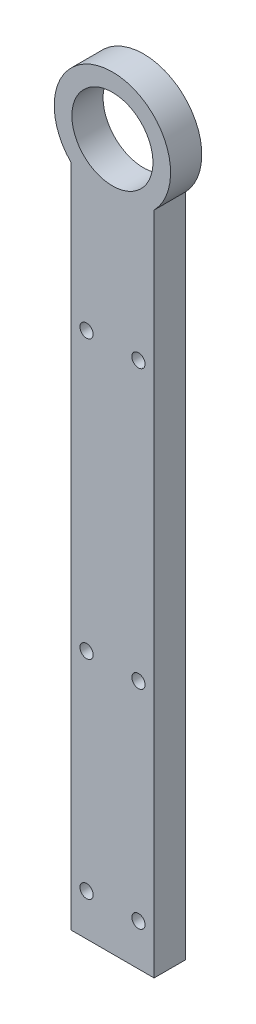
SolidWorks part; units mm, degrees
ref_plane "Front Plane" through (0, 0, 0) normal (0, 0, 1) x (1, 0, 0)
ref_plane "Top Plane" through (0, 0, 0) normal (0, 1, 0) x (1, 0, 0)
ref_plane "Right Plane" through (0, 0, 0) normal (1, 0, 0) x (0, 0, -1)
sketch "Sketch1" plane through (0, 0, 0) normal (0, 0, 1) x (1, 0, 0)
  line L2 (-12.6684, -12.4756) -> (-12.6684, -215.6111)
  line L3 (-12.6684, -215.6111) -> (12.7316, -215.6111)
  line L4 (12.7316, -12.4111) -> (12.7316, -215.6111)
  circle A0 centre (0, 0) radius 12.3825
  arc A1 (12.7316, -12.4111) -> (-12.6684, -12.4756) centre (0, 0) ccw
  circle A2 centre (-7.9059, -54.6142) radius 2.0193
  circle A3 centre (-7.8932, -202.9111) radius 2.0193
  circle A4 centre (7.9564, -202.9111) radius 2.0193
  circle A5 centre (7.9564, -54.5497) radius 2.0193
  circle A6 centre (-7.8932, -139.4111) radius 2.0193
  circle A7 centre (7.9564, -139.4111) radius 2.0193
  point P19 (0, 0)
  dimension "D1" = 24.765
  dimension "D2" = 215.6111
  dimension "D4" = 25.4
  dimension "D14" = 4.0386
  dimension "D15" = 4.0386
  dimension "D16" = 4.0386
  dimension "D19" = 4.0386
  dimension "D21" = 4.0386
  dimension "D23" = 4.0386
  dimension "D3" = 17.78
  dimension "D5" = 203.2
  dimension "D7" = 42.1386
  dimension "D8" = 42.1386
  dimension "D9" = 4.7625
  dimension "D10" = 4.7752
  dimension "D11" = 4.7752
  dimension "D12" = 12.7
  dimension "D13" = 12.7
  dimension "D17" = 76.2
  dimension "D18" = 76.2
  dimension "D20" = 4.7752
  dimension "D22" = 4.7752
  dimension "D24" = 4.7752
extrude "Boss-Extrude1" add sketch "Sketch1" along normal blind 9.525
